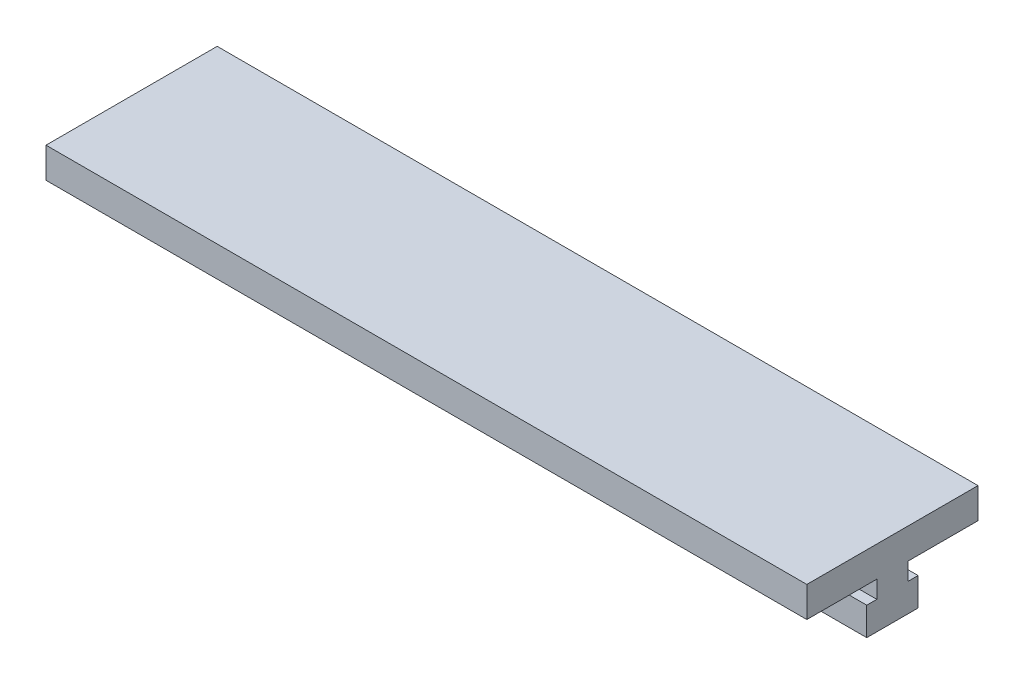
SolidWorks part; units mm, degrees
ref_plane "Front Plane" through (0, 0, 0) normal (0, 0, 1) x (1, 0, 0)
ref_plane "Top Plane" through (0, 0, 0) normal (0, 1, 0) x (1, 0, 0)
ref_plane "Right Plane" through (0, 0, 0) normal (1, 0, 0) x (0, 0, -1)
sketch3d "3DSketch1"
  line L0 (0, 0, 0) -> (200, 0, 0)
  dimension "D1" = 200
other "Liukukiskot 1.6043 LIUKUKISKO 8_45(1)"
ref_plane "Plane1" through (0, 0, 0) normal (1, 0, 0) x (0, 0, -1)
sketch "Sketch1" plane through (0, 0, 0) normal (1, 0, 0) x (0, 0, -1)
  line L0 (22.6328, 10.3321) -> (-22.3672, 10.3321)
  line L1 (-22.3672, 10.3321) -> (-22.3672, 2.3321)
  line L2 (-22.3672, 2.3321) -> (-3.9672, 2.3321)
  line L3 (-3.9672, 2.3321) -> (-3.9672, -2.2679)
  line L4 (-3.9672, -2.2679) -> (-6.6172, -2.2679)
  line L5 (-6.6172, -2.2679) -> (-6.6172, -9.6679)
  line L6 (-6.6172, -9.6679) -> (6.8828, -9.6679)
  line L7 (6.8828, -9.6679) -> (6.8828, -2.2679)
  line L8 (6.8828, -2.2679) -> (4.2328, -2.2679)
  line L9 (4.2328, -2.2679) -> (4.2328, 2.3321)
  line L10 (4.2328, 2.3321) -> (22.6328, 2.3321)
  line L11 (22.6328, 2.3321) -> (22.6328, 10.3321)
  point P12 (0, 0)
